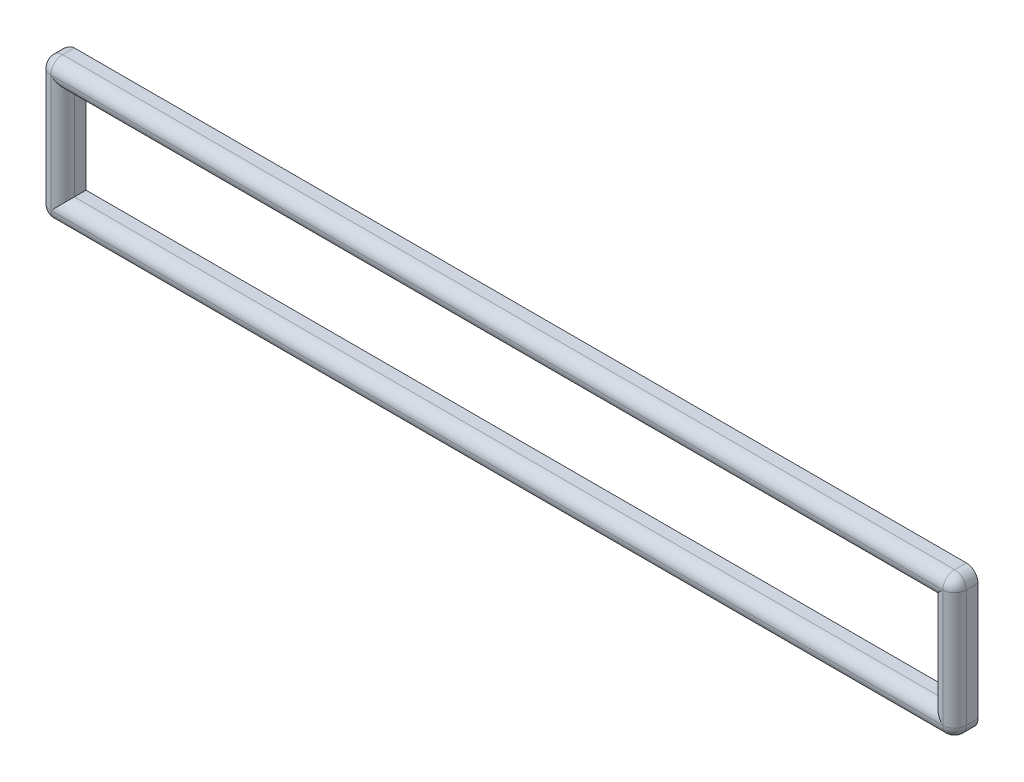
SolidWorks part; units mm, degrees
ref_plane "Front Plane" through (0, 0, 0) normal (0, 0, 1) x (1, 0, 0)
ref_plane "Top Plane" through (0, 0, 0) normal (0, 1, 0) x (1, 0, 0)
ref_plane "Right Plane" through (0, 0, 0) normal (1, 0, 0) x (0, 0, -1)
sketch "Sketch1" plane through (0, 0, 0) normal (0, 0, 1) x (1, 0, 0)
  line L1 (-49.53, 7.62) -> (49.53, 7.62)
  line L2 (-49.53, 7.62) -> (-49.53, -7.62)
  line L3 (-49.53, -7.62) -> (49.53, -7.62)
  line L4 (49.53, 7.62) -> (49.53, -7.62)
  line L5 (-49.53, 7.62) -> (49.53, -7.62) construction
  line L6 (-49.53, -7.62) -> (49.53, 7.62) construction
  point P0 (0, 0)
  dimension "D1" = 99.06
  dimension "D2" = 15.24
extrude "Boss-Extrude1" add sketch "Sketch1" along normal blind 2.54
sketch "Sketch2" plane through (0, 0, 2.54) normal (0, 0, 1) x (1, 0, 0)
  line L1 (-46.99, 5.08) -> (46.99, 5.08)
  line L2 (-46.99, 5.08) -> (-46.99, -5.08)
  line L3 (-46.99, -5.08) -> (46.99, -5.08)
  line L4 (46.99, 5.08) -> (46.99, -5.08)
  line L5 (-46.99, 5.08) -> (46.99, -5.08) construction
  line L6 (-46.99, -5.08) -> (46.99, 5.08) construction
  point P0 (0, 0)
  dimension "D1" = 93.98
  dimension "D2" = 10.16
extrude "Cut-Extrude1" cut sketch "Sketch2" against normal through all
fillet "Fillet1" radius 1.27 1 edges at (0, 7.62, 2.54)
fillet "Fillet2" radius 1.27 14 edges at (-49.53, -7.62, 1.27) (-49.53, 0, 0) (-49.53, 7.62, 0.635) (-49.53, 7.248, 2.168) (-49.53, -0.635, 2.54) (0, -7.62, 2.54) (49.53, -7.62, 1.27) (49.53, 7.248, 2.168) (49.53, 7.62, 0.635) (49.53, -0.635, 2.54) (46.99, 0, 2.54) (0, 5.08, 2.54) (-46.99, 0, 2.54) (0, -5.08, 2.54)
